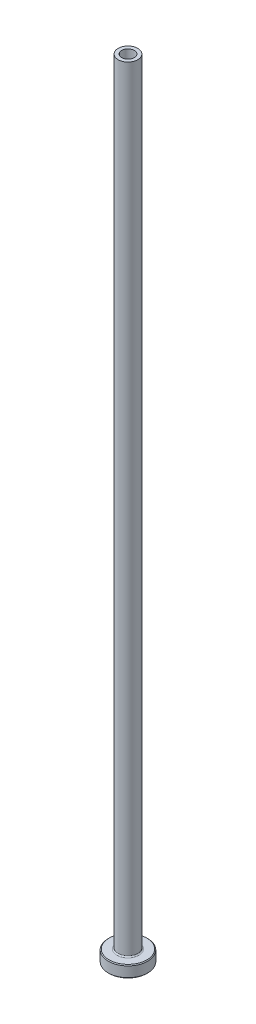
SolidWorks part; units mm, degrees
ref_plane "Front Plane" through (0, 0, 0) normal (0, 0, 1) x (1, 0, 0)
ref_plane "Top Plane" through (0, 0, 0) normal (0, 1, 0) x (1, 0, 0)
ref_plane "Right Plane" through (0, 0, 0) normal (1, 0, 0) x (0, 0, -1)
sketch "Sketch1" plane through (0, 0, 0) normal (0, 0, 1) x (1, 0, 0)
  line L0 (-1.6, 200) -> (-2.5, 200)
  line L1 (-2.5, 200) -> (-2.5, 3)
  line L2 (-2.5, 3) -> (-5, 3)
  line L3 (-5, 3) -> (-5, 0)
  line L4 (5.5, 0) -> (-5.5, 0) construction
  line L5 (-5, 0) -> (-1.85, 0)
  line L6 (-1.6, 155) -> (-1.6, 200)
  line L7 (0, 92.1877) -> (0, -15.5353) construction
  line L8 (0, -5.5) -> (0, 5.5) construction
  line L9 (-1.6, 155) -> (-1.85, 143)
  line L10 (-1.85, 143) -> (-1.85, 0)
  dimension "D1" = 0.25
  dimension "ID" = 3.2
  dimension "OD" = 5
  dimension "L" = 200
  dimension "H" = 10
  dimension "T" = 3
  dimension "N" = 45
  dimension "D2" = 12
revolve "Revolve1" add sketch "Sketch1" angle 360 about L7
fillet "Fillet1" radius 0.3 1 edges at (0, 3, 2.5)
chamfer "Chamfer1" distance 0.2 angle 45 2 edges at (0, 3, 5) (0, 0, 5)
chamfer "Chamfer3" distance 0.5 angle 45 1 edges at (0, 0, 1.85)
